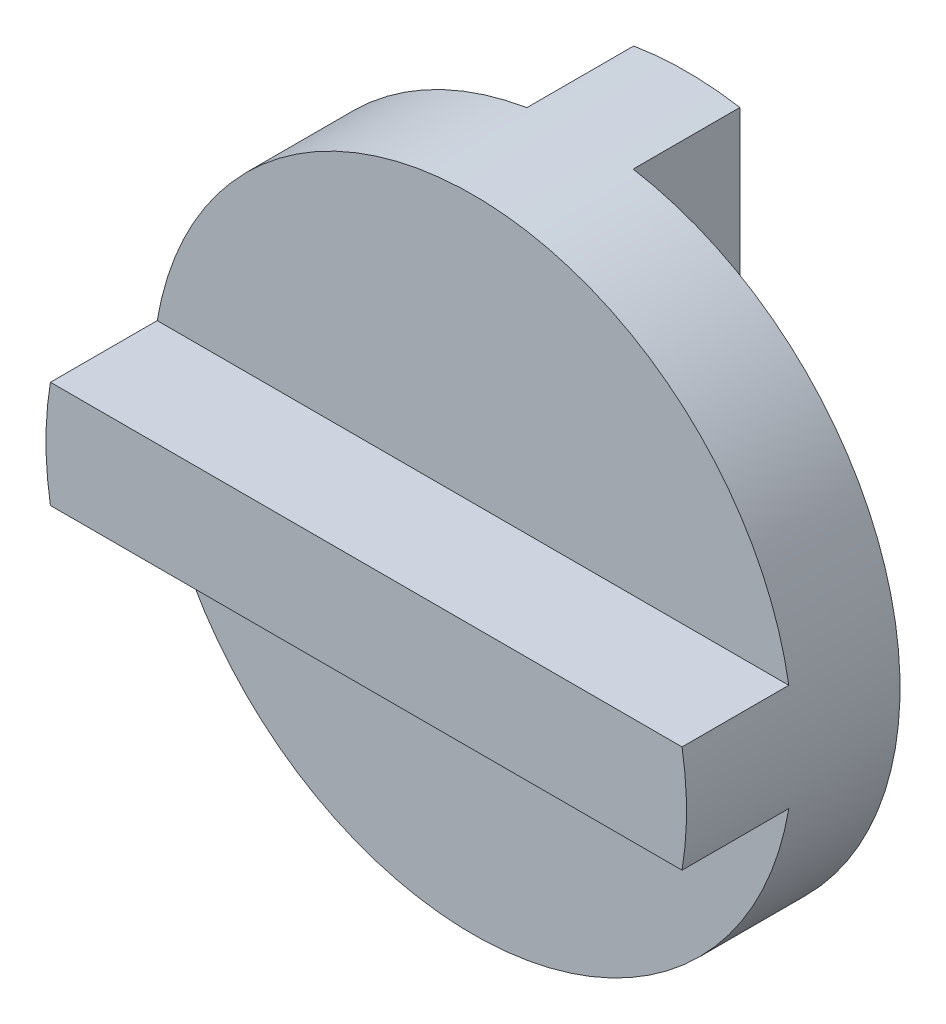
SolidWorks part; units mm, degrees
ref_plane "Plan de face" through (0, 0, 0) normal (0, 0, 1) x (1, 0, 0)
ref_plane "Plan de dessus" through (0, 0, 0) normal (0, 1, 0) x (1, 0, 0)
ref_plane "Plan de droite" through (0, 0, 0) normal (1, 0, 0) x (0, 0, -1)
sketch "Esquisse2" plane through (0, 0, 0) normal (0, 0, 1) x (1, 0, 0)
  circle A0 centre (0, 0) radius 30
extrude "Boss.-Extru.1" add sketch "Esquisse2" along normal blind 10
sketch "Esquisse3" plane through (0, 0, 10) normal (0, 0, 1) x (1, 0, 0)
  line L0 (-30, 0) -> (30, 0) construction
  line L3 (-29.5804, 5) -> (29.5804, 5)
  line L4 (29.5804, -5) -> (-29.5804, -5)
  circle A0 centre (0, 0) radius 30 construction
  arc A1 (-30, 0) -> (-29.5804, 5) centre (0, 0) cw
  arc A2 (-30, 0) -> (-29.5804, -5) centre (0, 0) ccw
  arc A3 (30, 0) -> (29.5804, 5) centre (0, 0) ccw
  arc A4 (30, 0) -> (29.5804, -5) centre (0, 0) cw
  dimension "D1" = 5
  dimension "D2" = 5
extrude "Boss.-Extru.5" add sketch "Esquisse3" along normal blind 10
sketch "Esquisse5" plane through (0, 0, 0) normal (0, 0, -1) x (-1, 0, 0)
  line L0 (-5, 29.5804) -> (-5, -29.5804)
  line L1 (0, 30) -> (0, -30) construction
  line L2 (4.9561, 29.5878) -> (4.9561, -29.5878)
  circle A0 centre (0, 0) radius 30 construction
  arc A1 (0, 30) -> (-5, 29.5804) centre (0, 0) ccw
  arc A2 (0, 30) -> (4.9561, 29.5878) centre (0, 0) cw
  arc A3 (0, -30) -> (-5, -29.5804) centre (0, 0) cw
  arc A4 (0, -30) -> (4.9561, -29.5878) centre (0, 0) ccw
  dimension "D1" = 4.9561
  dimension "D2" = 5
extrude "Boss.-Extru.6" add sketch "Esquisse5" along normal blind 10
